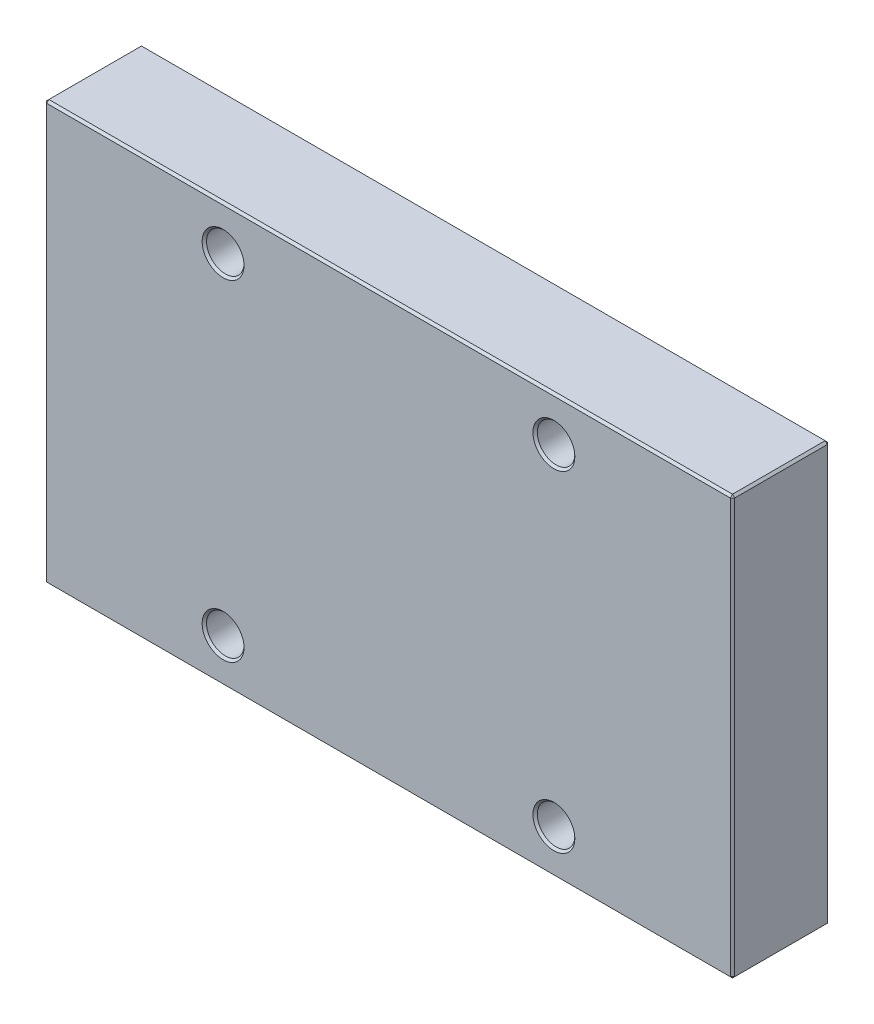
SolidWorks part; units mm, degrees
ref_plane "XY" through (0, 0, 0) normal (0, 0, 1) x (1, 0, 0)
ref_plane "XZ" through (0, 0, 0) normal (0, 1, 0) x (1, 0, 0)
ref_plane "YZ" through (0, 0, 0) normal (1, 0, 0) x (0, 0, -1)
sketch "Esquisse1" plane through (0, 0, 0) normal (0, 0, 1) x (1, 0, 0)
  line L0 (-78, 47.5) -> (78, 47.5)
  line L1 (-78, 47.5) -> (-78, -47.5)
  line L2 (78, -47.5) -> (-78, -47.5)
  line L3 (78, -47.5) -> (78, 47.5)
  line L4 (-36.7235, 0) -> (21.6925, 0) construction
  line L5 (0, 23.2297) -> (0, -25.2794) construction
  circle A0 centre (-37.5, -37.5) radius 4.25
  circle A2 centre (-37.5, 37.5) radius 4.25
  circle A3 centre (37.5, -37.5) radius 4.25
  circle A4 centre (37.5, 37.5) radius 4.25
  dimension "D7" = 8.5
  dimension "D1" = 156
  dimension "D2" = 78
  dimension "D3" = 95
  dimension "D4" = 47.5
  dimension "D5" = 37.5
  dimension "D6" = 37.5
extrude "Base-Extrusion" add sketch "Esquisse1" against normal blind 22
sketch "Esquisse2" plane through (0, 0, -22) normal (0, 0, -1) x (-1, 0, 0)
  line L0 (0, 0) -> (0, 25.0077) construction
  line L1 (0, 0) -> (21.9347, 0) construction
  circle A0 centre (-37.5, 37.5) radius 7
  circle A1 centre (-37.5, -37.5) radius 7
  circle A2 centre (37.5, -37.5) radius 7
  circle A3 centre (37.5, 37.5) radius 7
  dimension "D1" = 14
extrude "Enlèv. mat.-Extru.1" cut sketch "Esquisse2" against normal blind 10
chamfer "Chanfrein1" distance 0.5 angle 45
chamfer "Chanfrein2" distance 0.5 angle 45
chamfer "Chanfrein3" distance 0.5 angle 45
